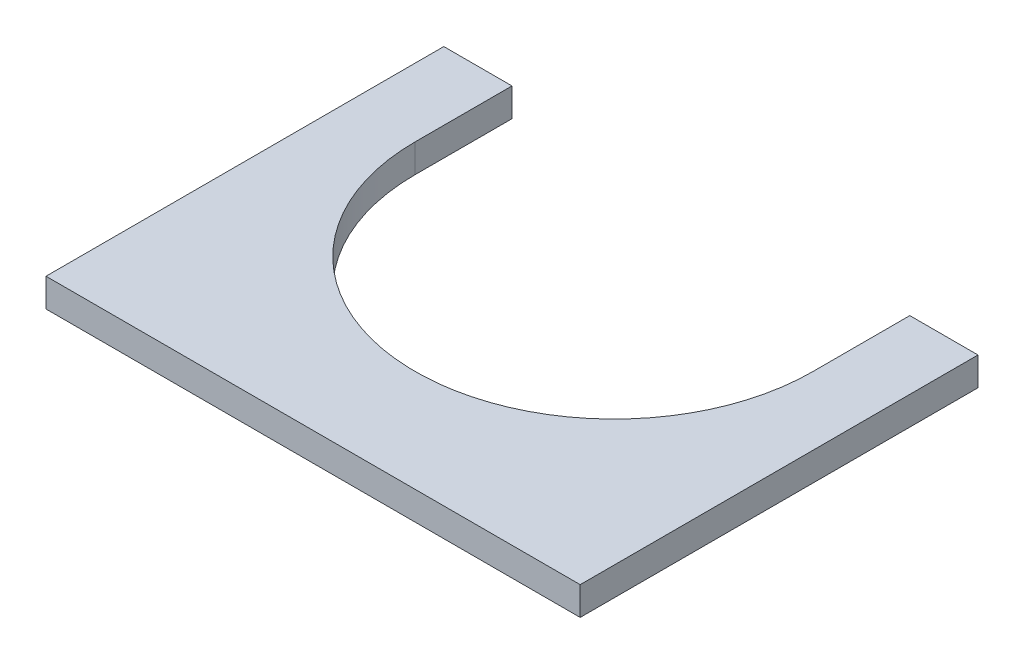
SolidWorks part; units mm, degrees
ref_plane "Piano frontale" through (0, 0, 0) normal (0, 0, 1) x (1, 0, 0)
ref_plane "Piano superiore" through (0, 0, 0) normal (0, 1, 0) x (1, 0, 0)
ref_plane "Piano destro" through (0, 0, 0) normal (1, 0, 0) x (0, 0, -1)
sketch "Schizzo1" plane through (0, 0, 0) normal (0, 1, 0) x (1, 0, 0)
  line L3 (-47, -57.5) -> (47, -57.5)
  line L11 (0, -57.5) -> (0, -7.25) construction
  line L12 (-47, -57.5) -> (-47, 12.5)
  line L13 (-47, 12.5) -> (-35, 12.5)
  line L14 (-35, 12.5) -> (-35, -4.5454)
  line L15 (35, -4.5454) -> (35, 12.5)
  line L16 (35, 12.5) -> (47, 12.5)
  line L17 (47, 12.5) -> (47, -57.5)
  arc A0 (-35, -4.5454) -> (35, -4.5454) centre (0, -4.5454) ccw
  point P0 (0, 0)
  point P2 (0, -39.5454)
  point P20 (35, 57.5)
base flange "Base-Flangia1" sketch "Schizzo1" thickness 5 reverse thickness direction no parameters "D1"=1.5
sketch "Linee di piegatura1" [suppressed] plane through (0, 0, 0) normal (0, 1, 0) x (1, 0, 0)
sketch "Casella di contorno1" [suppressed] plane through (0, 0, 0) normal (0, 1, 0) x (1, 0, 0)
sheet metal parameters "Lamiera1" thickness 5 parameters "D1"=1.5
flat pattern "Ripetizione piatta1"
sketch "Linee di piegatura2" plane through (0, 0, 0) normal (0, 1, 0) x (1, 0, 0)
sketch3d "Casella di contorno2" [suppressed]
  line L0 (47, -52.9546, 0) -> (-47, -52.9546, 0) construction
  line L1 (47, 17.0454, 0) -> (-47, 17.0454, 0) construction
  line L2 (47, -52.9546, 0) -> (47, 17.0454, 0) construction
  line L3 (-47, -52.9546, 0) -> (-47, 17.0454, 0) construction
equation "\"D4@Schizzo1\"=\"D3@Schizzo1\""
